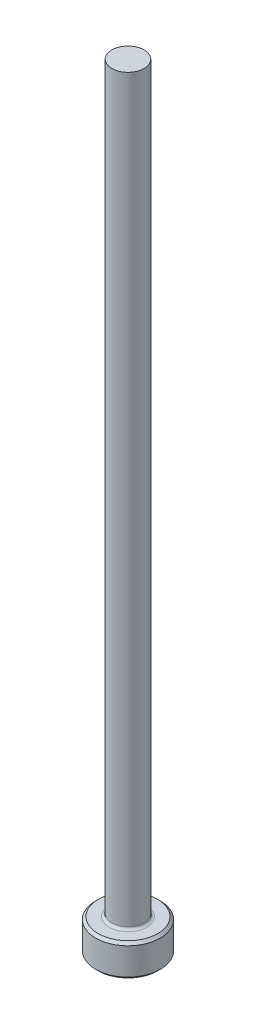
SolidWorks part; units mm, degrees
ref_plane "Front Plane" through (0, 0, 0) normal (0, 0, 1) x (1, 0, 0)
ref_plane "Top Plane" through (0, 0, 0) normal (0, 1, 0) x (1, 0, 0)
ref_plane "Right Plane" through (0, 0, 0) normal (1, 0, 0) x (0, 0, -1)
sketch "Sketch1" plane through (0, 0, 0) normal (0, 0, 1) x (1, 0, 0)
  line L0 (0, 259.9588) -> (0, -15.1925) construction
  line L1 (0, 0) -> (-3.175, 0)
  line L2 (-3.175, 0) -> (-3.175, 3.175)
  line L3 (-3.175, 3.175) -> (-1.5875, 3.175)
  line L4 (-1.5875, 3.175) -> (-1.5875, 76.2)
  line L5 (-1.5875, 76.2) -> (0, 76.2)
  line L6 (0, 76.2) -> (0, 0)
  dimension "L" = 76.2
  dimension "H" = 6.35
  dimension "T" = 3.175
  dimension "D" = 3.175
revolve "Revolve1" add sketch "Sketch1" angle 360 about L0
chamfer "Chamfer1" distance 0.254 angle 45 2 edges at (0, 3.175, 3.175) (0, 0, 3.175)
fillet "Fillet1" radius 0.254 1 edges at (0, 3.175, 1.5875)
sketch "Pocket Sketch" plane through (0, 0, 0) normal (0, 0, 1) x (1, 0, 0)
  line L0 (-3.5719, 0) -> (-3.5719, 3.2004)
  line L1 (-3.5719, 3.2004) -> (-2.5479, 3.2004)
  line L2 (-1.7859, 3.9624) -> (-1.7859, 22.225)
  line L3 (-1.7859, 22.225) -> (0, 22.225)
  line L4 (0, 22.225) -> (0, 0)
  line L5 (0, 0) -> (-3.5719, 0)
  line L6 (0, 12.6104) -> (0, -2.4989) construction
  line L7 (-3.175, 2.921) -> (-3.175, 0.254) construction
  line L8 (2.921, 3.175) -> (-2.921, 3.175) construction
  line L9 (-1.5875, 76.2) -> (-1.5875, 3.429) construction
  line L10 (-2.5479, 3.2004) -> (-1.7859, 3.9624)
  point P3 (-1.7859, 3.2004)
  dimension "D1" = 7.1437
  dimension "D2" = 0.3969
  dimension "D3" = 0.0254
  dimension "D4" = 0.1984
  dimension "D5" = 3.5719
  dimension "D6" = 22.225
